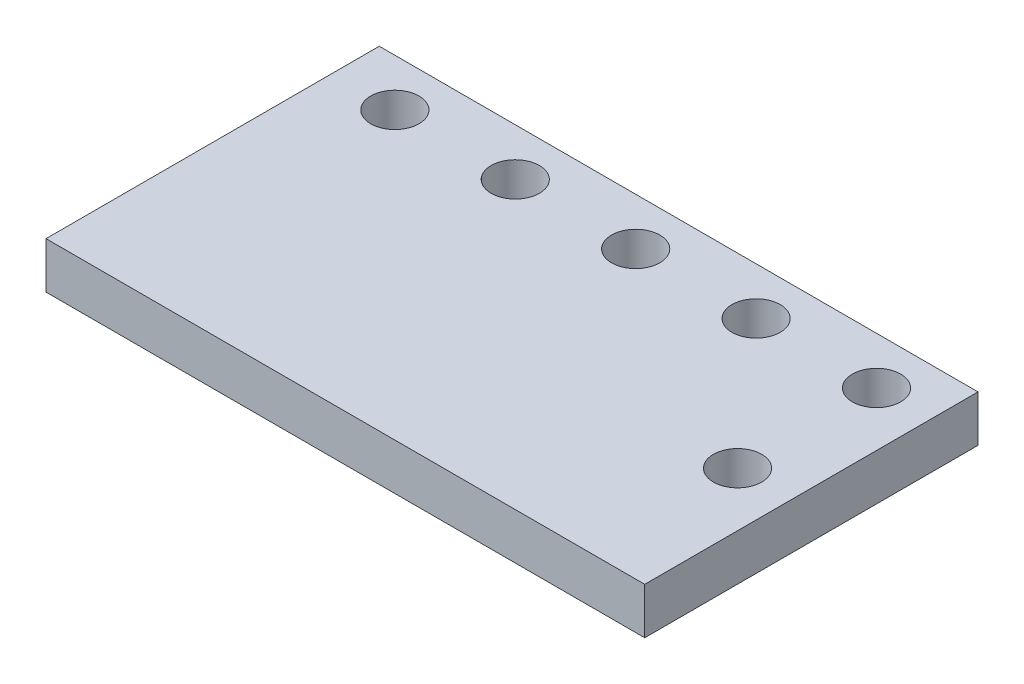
SolidWorks part; units mm, degrees
ref_plane "Front Plane" through (0, 0, 0) normal (0, 0, 1) x (1, 0, 0)
ref_plane "Top Plane" through (0, 0, 0) normal (0, 1, 0) x (1, 0, 0)
ref_plane "Right Plane" through (0, 0, 0) normal (1, 0, 0) x (0, 0, -1)
sketch "Sketch1" plane through (0, 0, 0) normal (0, 1, 0) x (1, 0, 0)
  line L0 (-82.0899, -45.6954) -> (82.0899, 45.6954) construction
  line L1 (-82.0899, 45.6954) -> (82.0899, 45.6954)
  line L2 (-82.0899, 45.6954) -> (-82.0899, -45.6954)
  line L3 (-82.0899, -45.6954) -> (82.0899, -45.6954)
  line L4 (82.0899, 45.6954) -> (82.0899, -45.6954)
extrude "Extrude1" add sketch "Sketch1" along normal blind 12.7
sketch "Sketch2" plane through (0, 12.7, 0) normal (0, 1, 0) x (-1, 0, 0)
  circle A0 centre (-67.247, -32.7093) radius 6.6145
extrude "Cut-Extrude1" cut sketch "Sketch2" against normal through all
pattern_linear "LPattern2" count 5 spacing 33.02 along (-1, 0, 0) count 2 spacing 38.1 along (0, 0, 1) of "Cut-Extrude1"
